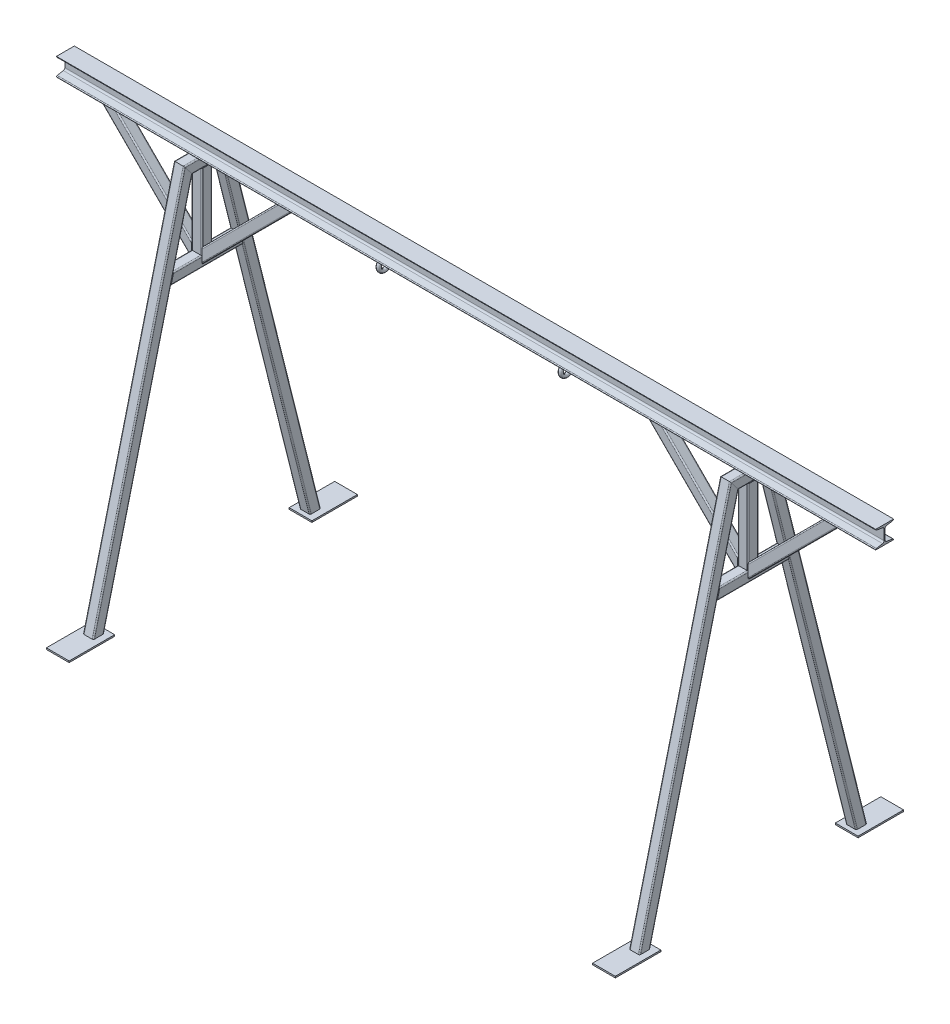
SolidWorks part; units mm, degrees
other "<Welded Ring>-<Fillet2>"
ref_plane "Default Plane" through (1905, 0, -660.4) normal (0, -1, 0) x (-1, 0, 0)
sketch3d "Bounding-Box_Cut-List-Item7"
  line L0 (152.4, 0, 0) -> (152.4, 304.8, 0) construction
  line L1 (152.4, 304.8, 0) -> (0, 304.8, 0) construction
  line L2 (0, 304.8, 0) -> (0, 0, 0) construction
  line L3 (0, 0, 0) -> (152.4, 0, 0) construction
  line L4 (152.4, 0, 10) -> (152.4, 304.8, 10) construction
  line L5 (152.4, 304.8, 10) -> (0, 304.8, 10) construction
  line L6 (0, 304.8, 10) -> (0, 0, 10) construction
  line L7 (0, 0, 10) -> (152.4, 0, 10) construction
  line L8 (152.4, 0, 0) -> (152.4, 0, 10) construction
  line L9 (152.4, 304.8, 0) -> (152.4, 304.8, 10) construction
  line L10 (0, 304.8, 0) -> (0, 304.8, 10) construction
  line L11 (0, 0, 0) -> (0, 0, 10) construction
ref_plane "Front Plane" through (0, 0, 0) normal (0, 0, 1) x (1, 0, 0)
ref_plane "Top Plane" through (0, 0, 0) normal (0, 1, 0) x (1, 0, 0)
ref_plane "Right Plane" through (0, 0, 0) normal (1, 0, 0) x (0, 0, -1)
sketch "FootPrint" plane through (0, 0, 0) normal (0, 1, 0) x (1, 0, 0)
  line L1 (-1828.8, -762) -> (1828.8, -762) construction
  line L2 (-1828.8, -762) -> (-1828.8, 762) construction
  line L3 (-1828.8, 762) -> (1828.8, 762) construction
  line L4 (1828.8, -762) -> (1828.8, 762) construction
  line L5 (-1828.8, -762) -> (1828.8, 762) construction
  line L6 (-1828.8, 762) -> (1828.8, -762) construction
  point P0 (0, 0)
  dimension "D1" = 3657.6
  dimension "D2" = 1524
ref_plane "Plane1" through (-1828.8, 0, 0) normal (1, 0, 0) x (0, 0, -1)
sketch "Side Layout" plane through (-1828.8, 0, 0) normal (1, 0, 0) x (0, 0, -1)
  line L0 (0, 0) -> (0, 2438.4) construction
  line L1 (-762, 0) -> (762, 0) construction
  line L2 (-762, 0) -> (-152.4, 2438.4)
  line L3 (-152.4, 2438.4) -> (152.4, 2438.4)
  line L4 (-304.8, 1828.8) -> (304.8, 1828.8)
  line L5 (0, 2438.4) -> (0, 1828.8)
  line L6 (762, 0) -> (152.4, 2438.4)
  dimension "D1" = 2438.4
  dimension "D2" = 609.6
  dimension "D3" = 304.8
sketch "Top Bar Layout" plane through (0, 0, 0) normal (0, 0, 1) x (1, 0, 0)
  line L0 (-2743.2, 2438.4) -> (2743.2, 2438.4)
  line L1 (0, 0) -> (0, 2438.4) construction
  line L2 (-2438.4, 2438.4) -> (-1828.8, 1828.8)
  line L3 (-1828.8, 2438.4) -> (-1828.8, 1828.8) construction
  dimension "D1" = 5486.4
  dimension "D2" = 45
other "Tube (square) 70 X 70 X 4.0(1)"
ref_plane "Plane2" through (-1828.8, 0, 762) normal (0, 0.9701, -0.2425) x (0, 0.2425, 0.9701)
sketch "Sketch1" plane through (-1828.8, 0, 762) normal (0, 0.9701, -0.2425) x (0, 0.2425, 0.9701)
  line L0 (-27, -31) -> (27, -31)
  line L1 (-31, -27) -> (-31, 27)
  line L2 (27, 31) -> (-27, 31)
  line L3 (31, 27) -> (31, -27)
  line L4 (-27, -35) -> (27, -35)
  line L5 (-35, -27) -> (-35, 27)
  line L6 (27, 35) -> (-27, 35)
  line L7 (35, 27) -> (35, -27)
  line L8 (-35, 0) -> (-31, 0) construction
  line L9 (-31, 0) -> (31, 0) construction
  line L10 (31, 0) -> (35, 0) construction
  line L12 (0, 35) -> (0, 31) construction
  line L13 (0, 31) -> (0, -31) construction
  line L14 (0, -31) -> (0, -35) construction
  arc A0 (35, 27) -> (27, 35) centre (27, 27) ccw
  arc A1 (27, -35) -> (35, -27) centre (27, -27) ccw
  arc A2 (-35, -27) -> (-27, -35) centre (-27, -27) ccw
  arc A3 (-27, 35) -> (-35, 27) centre (-27, 27) ccw
  arc A4 (-27, 31) -> (-31, 27) centre (-27, 27) ccw
  arc A5 (31, 27) -> (27, 31) centre (27, 27) ccw
  arc A6 (27, -31) -> (31, -27) centre (27, -27) ccw
  arc A7 (-31, -27) -> (-27, -31) centre (-27, -27) ccw
  point P2 (-35, 35)
  point P33 (-35, -35)
  point P34 (35, -35)
  point P36 (35, 35)
  point P37 (0, 0)
  dimension "D1" = 8
  dimension "Thickness" = 4
  dimension "V_leg" = 70
  dimension "H_leg" = 70
mirror "Mirror1" about plane through (-1828.8, 0, 0) normal (1, 0, 0)
mirror "Mirror2" about plane through (0, 0, 0) normal (1, 0, 0)
other "Sc beam SC 120(1)"
ref_plane "Plane3" through (-2743.2, 2438.4, 0) normal (1, 0, 0) x (0, 1, 0)
sketch "Sketch11" plane through (-2743.2, 2438.4, 0) normal (1, 0, 0) x (0, 1, 0)
  line L0 (-60, -60) -> (-60, -58.8122)
  line L1 (-54.9865, -52.8939) -> (-13.2771, -45.9418)
  line L2 (-3.25, -34.1051) -> (-3.25, 34.1051)
  line L3 (-13.2771, 45.9418) -> (-54.9865, 52.8939)
  line L4 (-60, 58.8122) -> (-60, 60)
  line L5 (-60, 60) -> (60, 60)
  line L6 (60, 60) -> (60, 58.8122)
  line L7 (54.9865, 52.8939) -> (13.2771, 45.9418)
  line L8 (3.25, 34.1051) -> (3.25, -34.1051)
  line L9 (13.2771, -45.9418) -> (54.9865, -52.8939)
  line L10 (60, -58.8122) -> (60, -60)
  line L11 (60, -60) -> (-60, -60)
  line L14 (60, -49) -> (0, -49) construction
  line L15 (0, 60) -> (0, -60) construction
  line L16 (-3.25, 0) -> (3.25, 0) construction
  arc A0 (-13.2771, -45.9418) -> (-3.25, -34.1051) centre (-15.25, -34.1051) ccw
  arc A1 (-3.25, 34.1051) -> (-13.2771, 45.9418) centre (-15.25, 34.1051) ccw
  arc A2 (13.2771, 45.9418) -> (3.25, 34.1051) centre (15.25, 34.1051) ccw
  arc A3 (3.25, -34.1051) -> (13.2771, -45.9418) centre (15.25, -34.1051) ccw
  arc A4 (60, -58.8122) -> (54.9865, -52.8939) centre (54, -58.8122) ccw
  arc A5 (-60, -58.8122) -> (-54.9865, -52.8939) centre (-54, -58.8122) cw
  arc A6 (-54.9865, 52.8939) -> (-60, 58.8122) centre (-54, 58.8122) cw
  arc A7 (54.9865, 52.8939) -> (60, 58.8122) centre (54, 58.8122) ccw
  point P35 (0, 0)
  dimension "D7" = 9.463
  dimension "RI" = 12
  dimension "RA" = 6
  dimension "BF" = 120
  dimension "D6" = 9.463
  dimension "DEPTH" = 120
  dimension "TW" = 6.5
  dimension "D1" = 68.2102
  dimension "TF" = 11
other "Trim/Extend1"
sketch "Sketch12" plane through (0, 0, 0) normal (0, 1, 0) x (1, 0, 0)
  line L0 (-1828.8, -762) -> (-1828.8, -965.2) construction
  line L1 (-1905, -660.4) -> (-1752.6, -660.4)
  line L2 (-1905, -660.4) -> (-1905, -965.2)
  line L3 (-1905, -965.2) -> (-1752.6, -965.2)
  line L4 (-1752.6, -660.4) -> (-1752.6, -965.2)
  dimension "D1" = 203.2
  dimension "D2" = 152.4
  dimension "D3" = 304.8
extrude "Foot Plate" add sketch "Sketch12" against normal blind 10 separate body
mirror "Mirror3" about plane through (0, 0, 0) normal (1, 0, 0)
mirror "Mirror4" about plane through (0, 0, 0) normal (0, 0, 1)
other "Trim/Extend2"
ref_plane "Front Plane-Welded Ring" through (-609.6, 2438.4, 0) normal (-1, 0, 0) x (0, 0, -1)
ref_plane "Top Plane-Welded Ring" through (-609.6, 2438.4, 0) normal (0, -1, 0) x (0, 0, -1)
ref_plane "Right Plane-Welded Ring" through (-609.6, 2438.4, 0) normal (0, 0, -1) x (1, 0, 0)
inserted part "Welded Ring"
move or copy body "Body-Move/Copy2"
other "Distance1" parameters "D1"=609.6
mirror "Mirror5" about plane through (0, 0, 0) normal (1, 0, 0)
